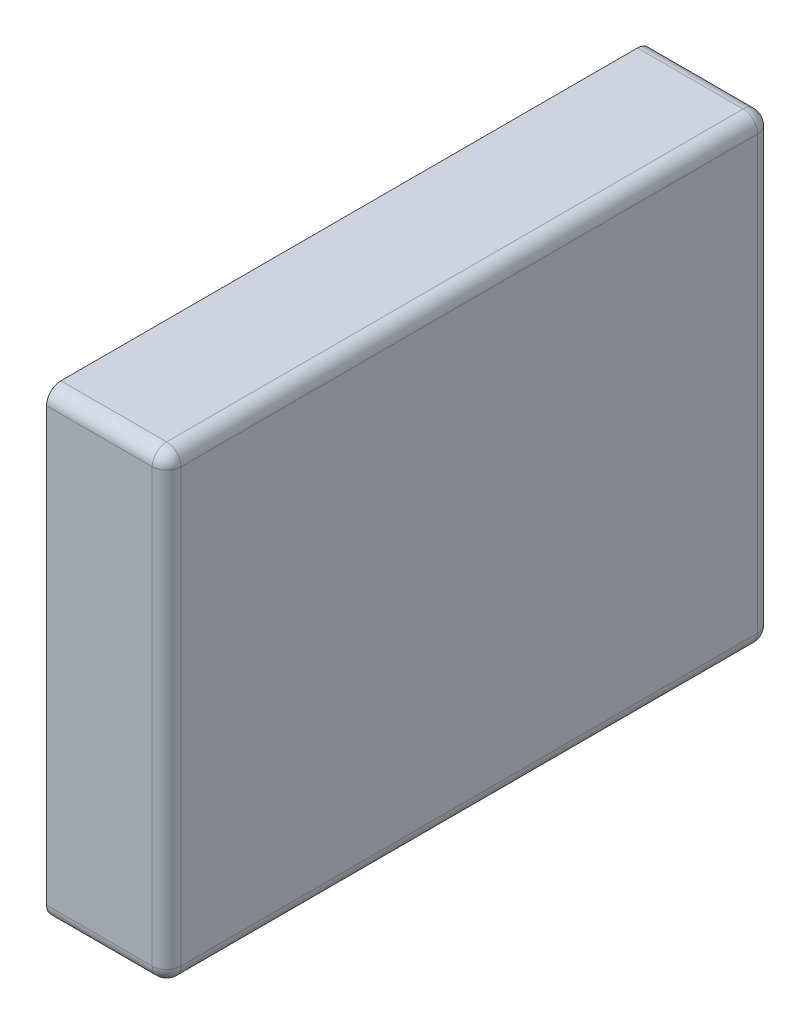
SolidWorks part; units mm, degrees
ref_plane "Front Plane" through (0, 0, 0) normal (0, 0, 1) x (1, 0, 0)
ref_plane "Top Plane" through (0, 0, 0) normal (0, 1, 0) x (1, 0, 0)
ref_plane "Right Plane" through (0, 0, 0) normal (1, 0, 0) x (0, 0, -1)
sketch "Sketch3" plane through (0, 0, 0) normal (1, 0, 0) x (0, 0, -1)
  line L1 (-63, 48) -> (63, 48)
  line L2 (-63, 48) -> (-63, -48)
  line L3 (-63, -48) -> (63, -48)
  line L4 (63, 48) -> (63, -48)
  line L5 (-63, 48) -> (63, -48) construction
  line L6 (-63, -48) -> (63, 48) construction
  point P0 (0, 0)
  dimension "D1" = 126
  dimension "D2" = 96
extrude "Boss-Extrude3" add sketch "Sketch3" along normal blind 25
fillet "Fillet9" radius 3 1 edges at (12.5, 48, 63)
fillet "Fillet10" radius 3 3 edges at (25, 48, -1.5) (25, 47.1213, 62.1213) (25, -1.5, 63)
fillet "Fillet11" radius 3 3 edges at (11, -48, 63) (24.1213, -48, 62.1213) (25, -48, -1.5)
fillet "Fillet12" radius 3 5 edges at (11, -48, -63) (24.1213, -47.1213, -63) (11, 48, -63) (24.1213, 47.1213, -63) (25, 0, -63)
sketch "Sketch5" plane through (0, 0, 0) normal (-1, 0, 0) x (0, 0, 1)
  line L0 (63, 45) -> (63, -45) construction
  line L1 (-62, 47) -> (62, 47)
  line L2 (-62, 47) -> (-62, -47)
  line L3 (-62, -47) -> (62, -47)
  line L4 (62, 47) -> (62, -47)
  line L5 (-62, 47) -> (62, -47) construction
  line L6 (-62, -47) -> (62, 47) construction
  line L7 (60, -48) -> (-60, -48) construction
  point P0 (0, 0)
  dimension "D1" = 1
  dimension "D2" = 1
extrude "Cut-Extrude4" cut sketch "Sketch5" against normal blind 1
sketch "Sketch6" plane through (1, 0, 0) normal (-1, 0, 0) x (0, 0, 1)
  line L0 (63, 45) -> (63, -45) construction
  line L1 (-61, 46) -> (61, 46)
  line L2 (-61, 46) -> (-61, -46)
  line L3 (-61, -46) -> (61, -46)
  line L4 (61, 46) -> (61, -46)
  line L5 (-61, 46) -> (61, -46) construction
  line L6 (-61, -46) -> (61, 46) construction
  line L7 (60, -48) -> (-60, -48) construction
  point P0 (0, 0)
  dimension "D1" = 2
  dimension "D2" = 2
extrude "Cut-Extrude5" cut sketch "Sketch6" against normal blind 20
fillet "Fillet17" radius 6 1 edges at (11, 46, 61)
fillet "Fillet18" radius 6 1 edges at (0.5, 47, 62)
fillet "Fillet19" radius 6 1 edges at (11, 46, -61)
fillet "Fillet20" radius 6 1 edges at (0.5, 47, -62)
fillet "Fillet21" radius 6 1 edges at (11, -46, 61)
fillet "Fillet22" radius 6 1 edges at (0.5, -47, 62)
fillet "Fillet23" radius 6 1 edges at (11, -46, -61)
fillet "Fillet24" radius 6 1 edges at (0.5, -47, -62)
